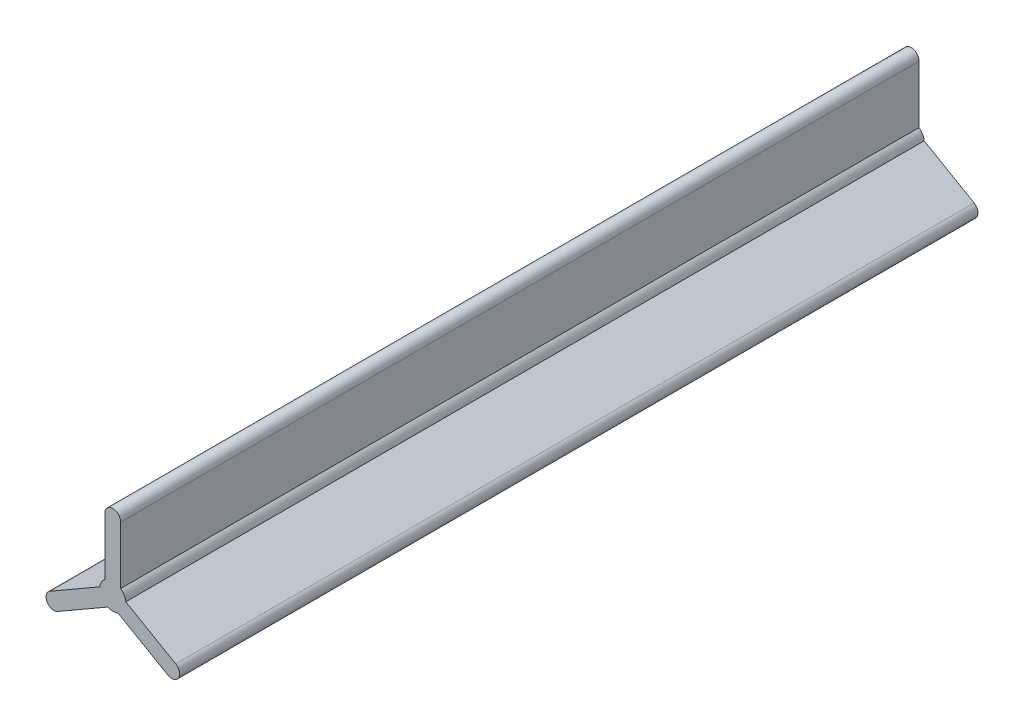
SolidWorks part; units mm, degrees
ref_plane "Front Plane" through (0, 0, 0) normal (0, 0, 1) x (1, 0, 0)
ref_plane "Top Plane" through (0, 0, 0) normal (0, 1, 0) x (1, 0, 0)
ref_plane "Right Plane" through (0, 0, 0) normal (1, 0, 0) x (0, 0, -1)
sketch "Sketch3" plane through (0, 0, 0) normal (0, 0, 1) x (1, 0, 0)
  circle A0 centre (0, 0) radius 10
  dimension "D1" = 20
extrude "Boss-Extrude2" add sketch "Sketch3" along normal mid plane 610
sketch "Sketch4" plane through (0, 0, 0) normal (0, 0, 1) x (1, 0, 0)
  line L0 (-6, 52) -> (-6, 8)
  line L1 (-6, 8) -> (6, 8)
  line L2 (6, 8) -> (6, 52)
  arc A0 (6, 52) -> (-6, 52) centre (0, 52) ccw
  circle A1 centre (0, 0) radius 10 construction
  point P1 (0, 58)
  dimension "D1" = 6
  dimension "D2" = 50
extrude "Boss-Extrude3" add sketch "Sketch4" along normal mid plane 610
pattern_circular "CirPattern1" count 3 over 360 about axis through (0, 0, 0) along (0, 0, 1) of "Boss-Extrude3"
